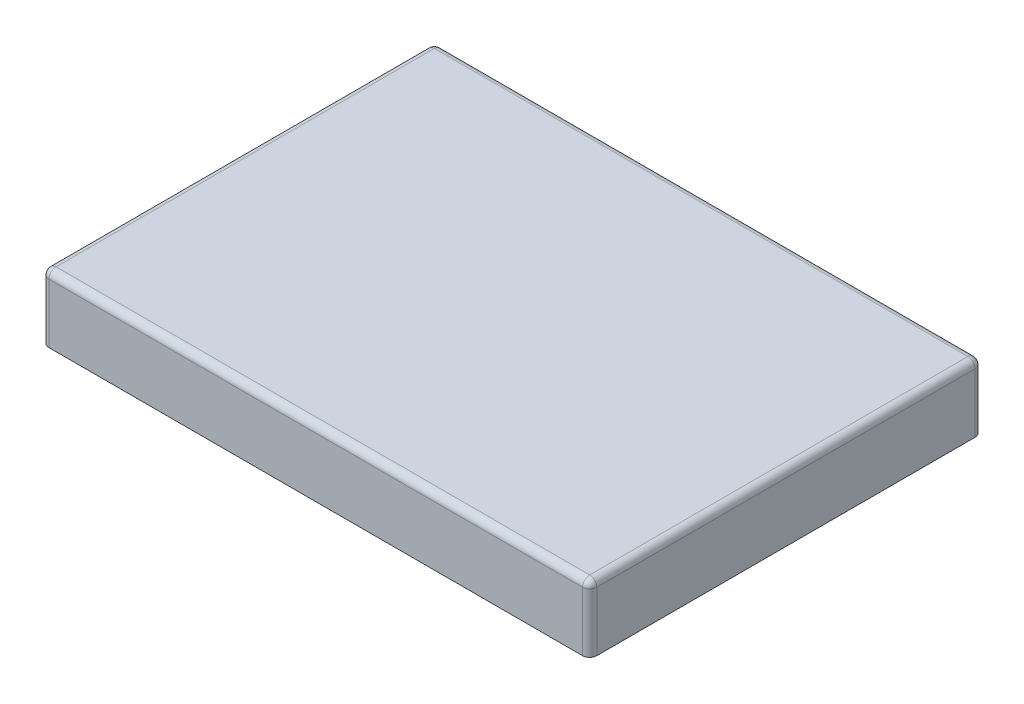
SolidWorks part; units mm, degrees
ref_plane "Front" through (0, 0, 0) normal (0, 0, 1) x (1, 0, 0)
ref_plane "Top" through (0, 0, 0) normal (0, 1, 0) x (1, 0, 0)
ref_plane "Right" through (0, 0, 0) normal (1, 0, 0) x (0, 0, -1)
body saved out of another part "Stock-generic-suitcase-1"
